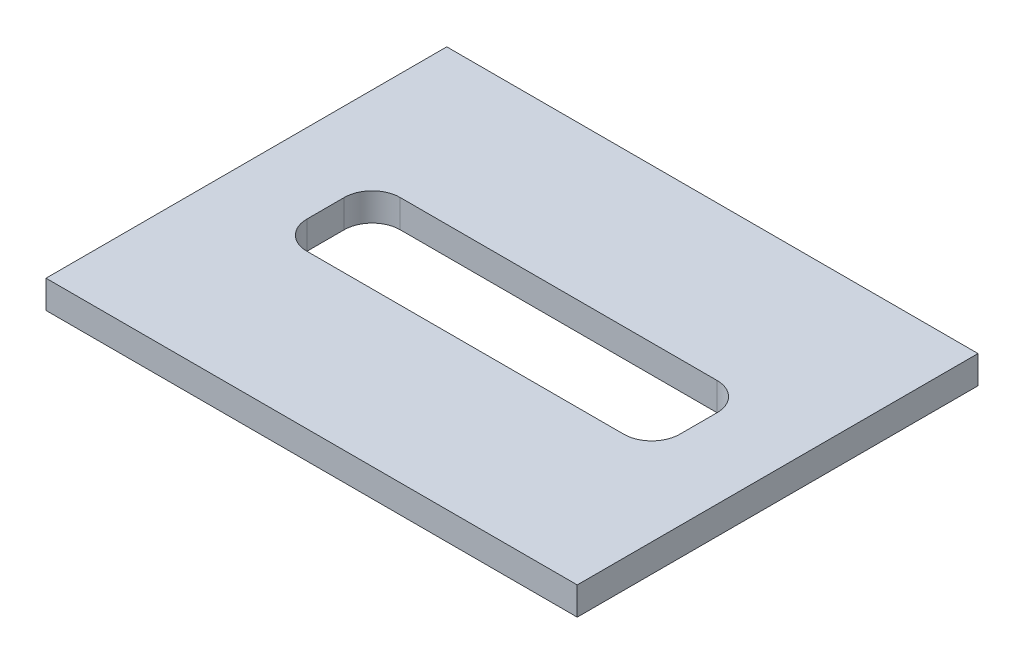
SolidWorks part; units mm, degrees
ref_plane "Front Plane" through (0, 0, 0) normal (0, 0, 1) x (1, 0, 0)
ref_plane "Top Plane" through (0, 0, 0) normal (0, 1, 0) x (1, 0, 0)
ref_plane "Right Plane" through (0, 0, 0) normal (1, 0, 0) x (0, 0, -1)
sketch "Sketch1" plane through (0, 0, 0) normal (0, 1, 0) x (1, 0, 0)
  line L1 (-28.5, -21.5) -> (28.5, -21.5)
  line L2 (-28.5, -21.5) -> (-28.5, 21.5)
  line L3 (-28.5, 21.5) -> (28.5, 21.5)
  line L4 (28.5, -21.5) -> (28.5, 21.5)
  line L5 (-28.5, -21.5) -> (28.5, 21.5) construction
  line L6 (-28.5, 21.5) -> (28.5, -21.5) construction
  point P0 (0, 0)
  dimension "D1" = 57
  dimension "D2" = 43
extrude "Boss-Extrude1" add sketch "Sketch1" along normal blind 3
sketch "Sketch2" plane through (0, 3, 0) normal (0, 1, 0) x (1, 0, 0)
  line L1 (-20, -5) -> (20, -5)
  line L2 (-20, -5) -> (-20, 5)
  line L3 (-20, 5) -> (20, 5)
  line L4 (20, -5) -> (20, 5)
  line L5 (-20, -5) -> (20, 5) construction
  line L6 (-20, 5) -> (20, -5) construction
  point P0 (0, 5)
  point P6 (20, 0)
  dimension "D1" = 40
  dimension "D2" = 10
extrude "Cut-Extrude1" cut sketch "Sketch2" against normal blind 10
fillet "Fillet1" radius 3 4 edges at (20, 1.5, 5) (20, 1.5, -5) (-20, 1.5, -5) (-20, 1.5, 5)
